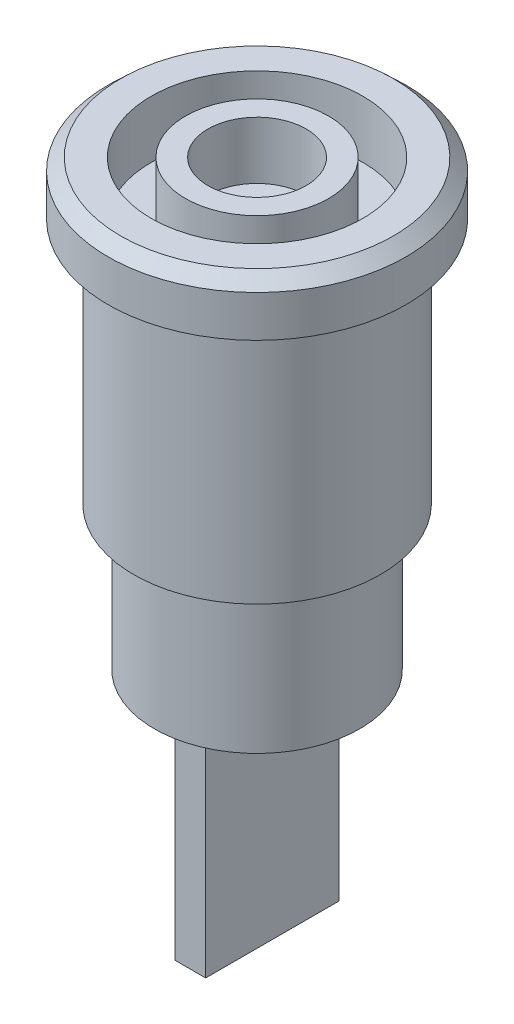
SolidWorks part; units mm, degrees
ref_plane "Face" through (0, 0, 0) normal (0, 0, 1) x (1, 0, 0)
ref_plane "Dessus" through (0, 0, 0) normal (0, 1, 0) x (1, 0, 0)
ref_plane "Droite" through (0, 0, 0) normal (1, 0, 0) x (0, 0, -1)
sketch "Esquisse1" plane through (0, 0, 0) normal (0, 0, 1) x (1, 0, 0)
  line L0 (0, 0) -> (0, 65.6041) construction
  line L1 (0, 0) -> (5, 0)
  line L2 (5, 0) -> (5, 7)
  line L3 (5, 7) -> (6, 7)
  line L4 (6, 7) -> (6, 19)
  line L5 (6, 19) -> (7.2465, 19)
  line L6 (7.2465, 19) -> (7.2465, 21.0173)
  line L7 (7.2465, 21.0173) -> (6.6362, 21.5938)
  line L8 (6.6362, 21.5938) -> (5.1537, 21.5938)
  line L9 (5.1537, 21.5938) -> (5.1537, 18.8018)
  line L10 (5.1537, 18.8018) -> (3.4818, 18.8018)
  line L11 (3.4818, 18.8018) -> (3.4818, 21.5938)
  line L12 (3.4818, 21.5938) -> (2.3917, 21.5938)
  line L13 (2.3917, 21.5938) -> (2.3917, 18.8018)
  line L14 (2.3917, 18.8018) -> (0, 18.8018)
  line L15 (0, 18.8018) -> (0, 0)
  dimension "D1" = 5
  dimension "D2" = 7
  dimension "D3" = 6
  dimension "D4" = 12
revolve "Révolution1" add sketch "Esquisse1" angle 360 about L0
sketch "Esquisse2" plane through (0, 0, 0) normal (0, -1, 0) x (1, 0, 0)
  line L1 (-0.75, 3.25) -> (0.75, 3.25)
  line L2 (-0.75, 3.25) -> (-0.75, -3.25)
  line L3 (-0.75, -3.25) -> (0.75, -3.25)
  line L4 (0.75, 3.25) -> (0.75, -3.25)
  line L5 (-0.75, 3.25) -> (0.75, -3.25) construction
  line L6 (-0.75, -3.25) -> (0.75, 3.25) construction
  point P0 (0, 0)
  dimension "D1" = 1.5
  dimension "D2" = 6.5
extrude "Extrusion1" add sketch "Esquisse2" along normal blind 11
